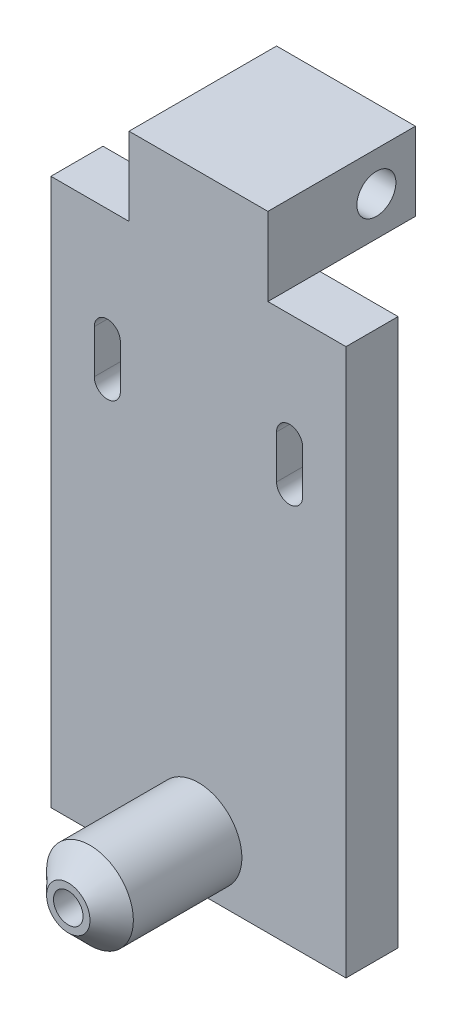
SolidWorks part; units mm, degrees
ref_plane "Face" through (0, 0, 0) normal (0, 0, 1) x (1, 0, 0)
ref_plane "Dessus" through (0, 0, 0) normal (0, 1, 0) x (1, 0, 0)
ref_plane "Droite" through (0, 0, 0) normal (1, 0, 0) x (0, 0, -1)
sketch "Esquisse1" plane through (0, 0, 0) normal (0, 0, 1) x (1, 0, 0)
  line L1 (0, 0) -> (68, 0)
  line L2 (0, 0) -> (0, 126)
  line L3 (0, 126) -> (68, 126)
  line L4 (68, 0) -> (68, 126)
  dimension "D1" = 68
  dimension "D2" = 126
extrude "Extrusion1" add sketch "Esquisse1" along normal blind 12
sketch "Esquisse2" plane through (0, 0, 12) normal (0, 0, 1) x (1, 0, 0)
  line L0 (68, 0) -> (68, 126) construction
  line L1 (0, 0) -> (68, 0) construction
  circle A0 centre (34, 12) radius 10
  dimension "D1" = 34
  dimension "D2" = 12
  dimension "D3" = 20
extrude "Extrusion2" add sketch "Esquisse2" along normal blind 30
chamfer "Chanfrein1" distance 5 angle 45 1 edges at (44, 12, 42)
hole_wizard "Trou taraudé M81" positions "Esquisse4" profile "Esquisse3" tap size "M8" standard "ISO"
sketch "Esquisse4" plane through (0, 0, 42) normal (0, 0, 1) x (1, 0, 0)
  circle A0 centre (34, 12) radius 5 construction
  point P0 (34, 12)
sketch "Esquisse3" plane through (34, 12, 42) normal (1, 0, 0) x (0, -1, 0)
  line L0 (0, 0) -> (0, 26.0429)
  line L1 (0, 26.0429) -> (3.4, 24)
  line L2 (3.4, 24) -> (3.4, 0)
  line L5 (3.4, 0) -> (0, 0)
  line L10 (0, 26.0429) -> (-3.4, 24) construction
  line L11 (0, -6.35) -> (0, 107.95) construction
  dimension "Diamètre du trou pour taraudage" = 6.8
  dimension "Profondeur du trou pour taraudage" = 24
  dimension "Angle de pointe" = 118
sketch "Esquisse5" plane through (0, 126, 0) normal (0, 1, 0) x (1, 0, 0)
  line L0 (68, -12) -> (0, -12) construction
  line L1 (18, -12) -> (50, -12)
  line L2 (18, -12) -> (18, 22)
  line L3 (18, 22) -> (50, 22)
  line L4 (50, -12) -> (50, 22)
  line L5 (0, -12) -> (0, 0) construction
  dimension "D1" = 32
  dimension "D2" = 18
  dimension "D3" = 34
extrude "Extrusion3" add sketch "Esquisse5" along normal blind 18
sketch "Esquisse6" plane through (18, 0, 0) normal (-1, 0, 0) x (0, 0, 1)
  line L0 (-22, 144) -> (-22, 126) construction
  line L1 (-22, 126) -> (0, 126) construction
  circle A0 centre (-13, 135) radius 4.5
  dimension "D1" = 9
  dimension "D2" = 9
  dimension "D3" = 9
extrude "Enlèv. mat.-Extru.1" cut sketch "Esquisse6" against normal through all
sketch "Esquisse7" plane through (0, 0, 12) normal (0, 0, 1) x (1, 0, 0)
  line L0 (0, 0) -> (68, 0) construction
  line L1 (0, 126) -> (0, 0) construction
  line L2 (10, 101) -> (10, 91)
  line L3 (68, 0) -> (68, 126) construction
  line L4 (16, 101) -> (16, 91)
  line L6 (52, 101) -> (52, 91)
  line L8 (58, 101) -> (58, 91)
  arc A0 (10, 101) -> (16, 101) centre (13, 101) cw
  arc A1 (10, 91) -> (16, 91) centre (13, 91) ccw
  arc A2 (52, 91) -> (58, 91) centre (55, 91) ccw
  arc A3 (52, 101) -> (58, 101) centre (55, 101) cw
  dimension "D1" = 6
  dimension "D2" = 6
  dimension "D3" = 10
  dimension "D4" = 10
  dimension "D5" = 91
  dimension "D6" = 91
  dimension "D7" = 10
  dimension "D8" = 10
extrude "Enlèv. mat.-Extru.2" cut sketch "Esquisse7" against normal through all
